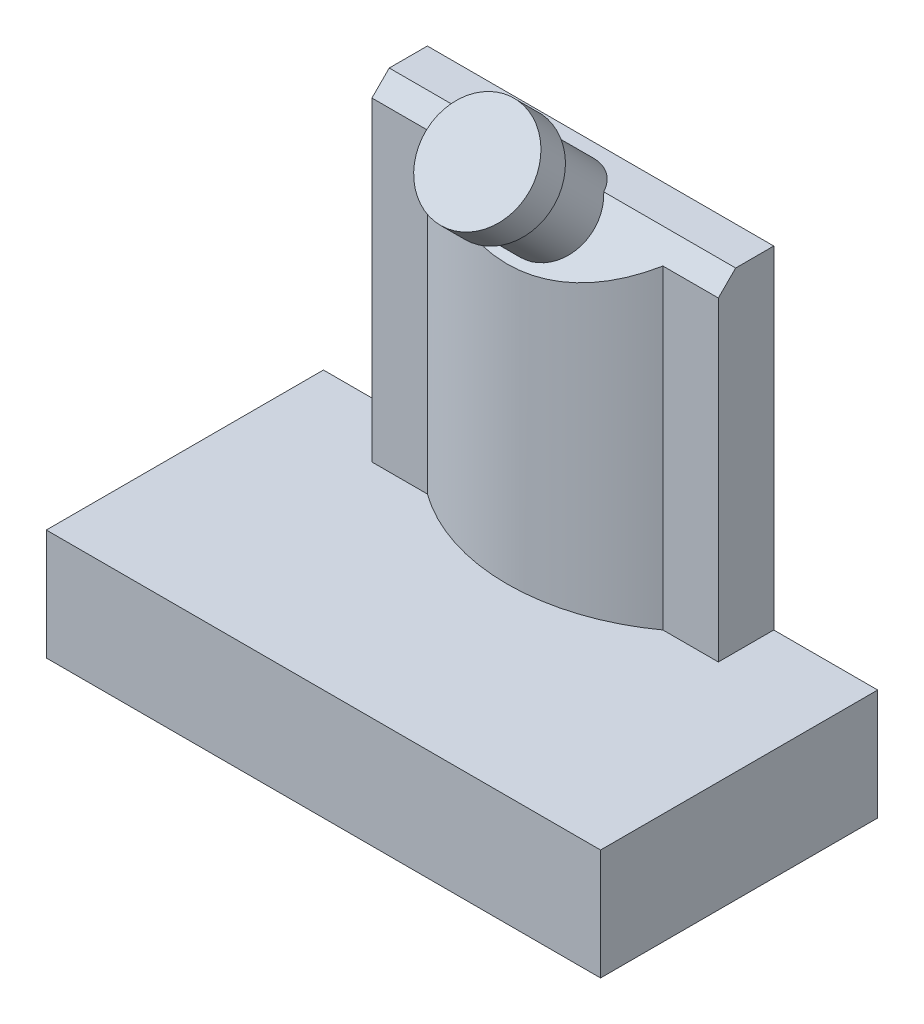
SolidWorks part; units mm, degrees
ref_plane "Vorne" through (0, 0, 0) normal (0, 0, 1) x (1, 0, 0)
ref_plane "Oben" through (0, 0, 0) normal (0, 1, 0) x (1, 0, 0)
ref_plane "Rechts" through (0, 0, 0) normal (1, 0, 0) x (0, 0, -1)
sketch "Skizze1" plane through (0, 0, 0) normal (0, 1, 0) x (1, 0, 0)
  line L1 (0, 0) -> (16, 0)
  line L2 (0, 0) -> (0, 8)
  line L3 (0, 8) -> (16, 8)
  line L4 (16, 0) -> (16, 8)
  dimension "D1" = 8
  dimension "D2" = 16
extrude "Linear austragen1" add sketch "Skizze1" along normal blind 3.2
sketch "Skizze2" plane through (0, 0, 0) normal (0, -1, 0) x (1, 0, 0)
  line L0 (0, -8) -> (0, 0) construction
  line L1 (1.6, -1.6) -> (14.4, -1.6)
  line L2 (1.6, -1.6) -> (1.6, -6.4)
  line L3 (1.6, -6.4) -> (14.4, -6.4)
  line L4 (14.4, -1.6) -> (14.4, -6.4)
  line L5 (16, 0) -> (16, -8) construction
  line L6 (0, 0) -> (16, 0) construction
  line L7 (16, -8) -> (0, -8) construction
  dimension "D1" = 1.6
  dimension "D2" = 1.6
  dimension "D3" = 1.6
  dimension "D4" = 1.6
extrude "Schnitt-Linear austragen1" cut sketch "Skizze2" against normal blind 2.1
sketch "Skizze3" plane through (0, 2.1, 0) normal (0, -1, 0) x (1, 0, 0)
  line L0 (0, 0) -> (16, 0) construction
  line L2 (16, 0) -> (16, -8) construction
  circle A0 centre (8.2, -3.9) radius 0.8
  circle A1 centre (8.2, -3.9) radius 1.5
  dimension "D1" = 3.9
  dimension "D2" = 7.8
extrude "Linear austragen2" add sketch "Skizze3" along normal blind 2
fillet "Verrundung1" radius 0.1 1 edges at (8.2, 0.1, -4.7)
sketch "Skizze4" plane through (0, 3.2, 0) normal (0, 1, 0) x (-1, 0, 0)
  line L0 (-3, -8) -> (-13, -8)
  line L1 (-16, -8) -> (0, -8) construction
  line L2 (-13, -8) -> (-13, -6.4)
  line L3 (-3, -8) -> (-3, -6.4)
  line L4 (-3, -6.4) -> (-4.6, -6.4)
  line L5 (-13, -6.4) -> (-11.4, -6.4)
  line L6 (-16, 0) -> (-16, -8) construction
  line L7 (0, -8) -> (0, 0) construction
  line L8 (-8, -5.3) -> (-8, -3.5028) construction
  line L9 (-8, -5.3) -> (-14.1366, -5.3) construction
  arc A0 (-4.6, -6.4) -> (-11.4, -6.4) centre (-8, -11.1045) ccw
  dimension "D1" = 3
  dimension "D2" = 3
  dimension "D3" = 1.6
  dimension "D4" = 1.6
  dimension "D5" = 1.6
  dimension "D6" = 1.1
extrude "Linear austragen3" add sketch "Skizze4" along normal blind 9.6
sketch "Skizze5" plane through (13, 0, 0) normal (1, 0, 0) x (0, 0, -1)
  line L0 (6.9, 12.8) -> (5.3, 11.2)
  line L1 (6.4, 12.8) -> (8, 12.8) construction
  line L2 (5.3, 12.8) -> (5.3, 3.2) construction
  line L3 (6.9, 12.8) -> (5.3, 12.8)
  line L4 (5.3, 12.8) -> (5.3, 11.2)
extrude "Schnitt-Linear austragen2" cut sketch "Skizze5" against normal through all
sketch "Skizze6" plane through (0, 2.95, 2.95) normal (0, 0.7071, 0.7071) x (1, 0, 0)
  line L0 (16, 2.2627) -> (16, 7.9196) construction
  line L1 (13, 14.7078) -> (3, 14.7078) construction
  circle A0 centre (8.2, 13.1707) radius 1.25
  dimension "D2" = 2.5
  dimension "D1" = 7.8
  dimension "D3" = 1.5371
extrude "Linear austragen4" add sketch "Skizze6" along normal blind 3 and the other way up to next
sketch "Skizze7" plane through (0, 5.0713, 5.0713) normal (0, 0.7071, 0.7071) x (1, 0, 0)
  line L0 (8.2, 14.4207) -> (8.2, 11.9207) construction
  line L1 (6.95, 13.1707) -> (9.45, 13.1707) construction
  circle A1 centre (8.2, 13.1707) radius 1.5
  circle A3 centre (8.2, 13.1707) radius 1.25 construction
  dimension "D1" = 3
extrude "Linear austragen5" add sketch "Skizze7" against normal blind 1
